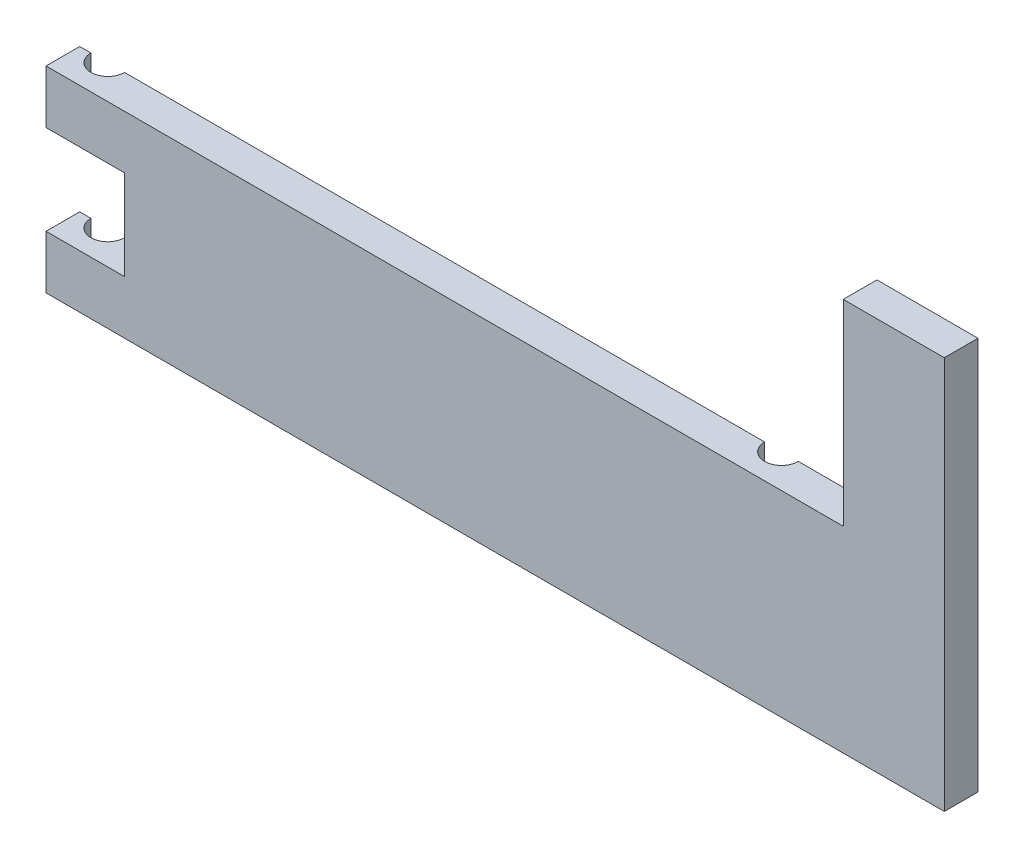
SolidWorks part; units mm, degrees
ref_plane "Plan de face" through (0, 0, 0) normal (0, 0, 1) x (1, 0, 0)
ref_plane "Plan de dessus" through (0, 0, 0) normal (0, 1, 0) x (1, 0, 0)
ref_plane "Plan de droite" through (0, 0, 0) normal (1, 0, 0) x (0, 0, -1)
sketch "Esquisse1" plane through (0, 0, 0) normal (0, 0, 1) x (1, 0, 0)
  line L0 (9, 126.1328) -> (9, -9.4638) construction
  line L1 (0, 0) -> (160, 0) construction
  line L2 (0, 0) -> (0, 120) construction
  line L3 (0, 120) -> (160, 120) construction
  line L4 (120, 50) -> (120, -6.9153) construction
  line L5 (-5, 121) -> (-5, -10) construction
  line L6 (-10.714, 17.5) -> (132.8358, 17.5) construction
  line L7 (155, 136.9664) -> (155, -26.1058) construction
  line L8 (137, 80.6011) -> (137, -4.7242) construction
  line L9 (-16.256, 70) -> (160, 70) construction
  line L10 (-9.4797, 25.5) -> (13.4274, 25.5) construction
  line L11 (153.523, 35) -> (-16.256, 35) construction
  line L12 (155, 70) -> (137, 70)
  line L13 (13.4274, 9.5) -> (-9.4797, 9.5) construction
  line L14 (137, 70) -> (137, 35)
  line L15 (137, 35) -> (-5, 35)
  line L16 (-5, 35) -> (-5, 25.5)
  line L17 (-5, 25.5) -> (9, 25.5)
  line L18 (9, 25.5) -> (9, 9.5)
  line L19 (9, 9.5) -> (-5, 9.5)
  line L20 (-5, 9.5) -> (-5, 0)
  line L21 (-5, 0) -> (155, 0)
  line L22 (155, 0) -> (155, 70)
  line L23 (146, 60) -> (146, -7.9939) construction
  dimension "D1" = 18
  dimension "D2" = 8
  dimension "D3" = 8
extrude "Extrusion1" add sketch "Esquisse1" along normal blind 6
sketch "Esquisse2" plane through (0, 0, 0) normal (0, -1, 0) x (1, 0, 0)
  circle A0 centre (0, 0) radius 3
  circle A1 centre (120, 0) radius 3
extrude "Enlèv. mat.-Extru.1" cut sketch "Esquisse2" against normal through all
